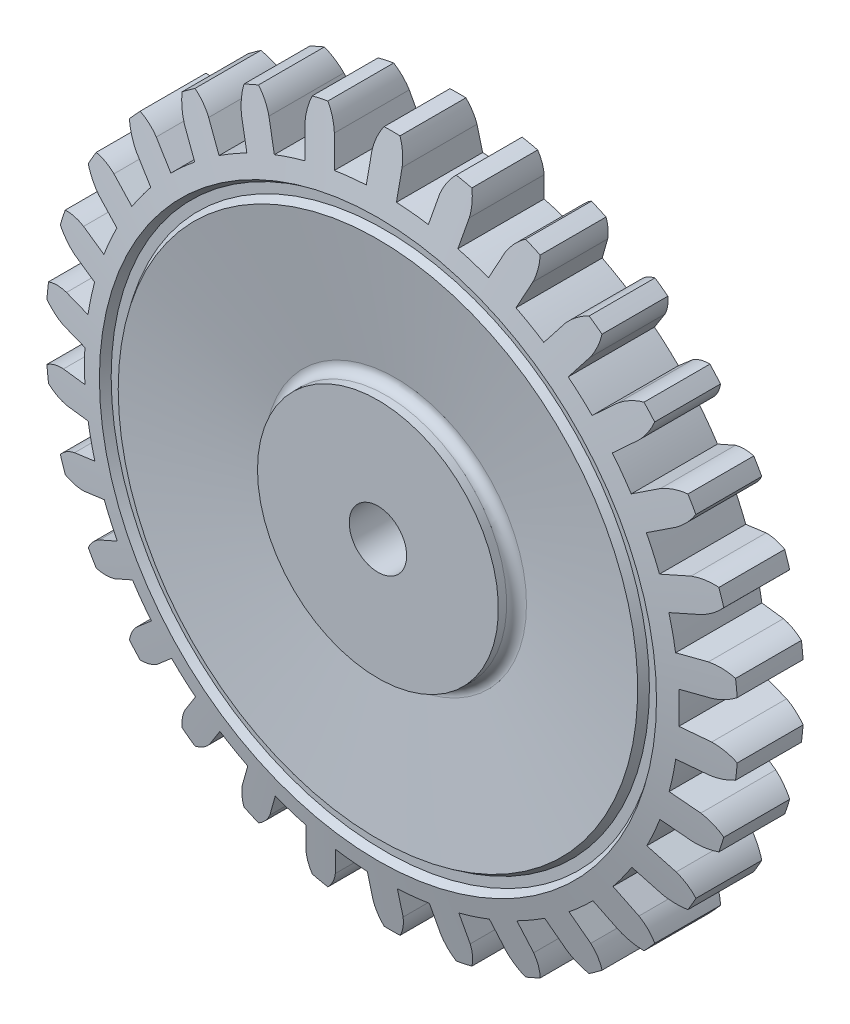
SolidWorks part; units mm, degrees
ref_plane "Front Plane" through (0, 0, 0) normal (0, 0, 1) x (1, 0, 0)
ref_plane "Top Plane" through (0, 0, 0) normal (0, 1, 0) x (1, 0, 0)
ref_plane "Right Plane" through (0, 0, 0) normal (1, 0, 0) x (0, 0, -1)
sketch "Sketch1" plane through (0, 0, 0) normal (1, 0, 0) x (0, 0, -1)
  line L0 (5, 0) -> (-5, 0)
  line L1 (3.5, 36.8) -> (-3.5, 36.8)
  line L2 (-5, 27.6) -> (-3.1331, 13.9182)
  line L3 (-4.25, 29.1) -> (-4.25, 28.1)
  line L4 (-3.5, 36.8) -> (-5, 29.6)
  line L5 (3.5, 36.8) -> (5, 29.6)
  line L6 (5, 12.8) -> (4.1261, 12.8)
  line L7 (-5, 29.6) -> (-4.25, 29.1)
  line L8 (-5, 0) -> (-5, 12.8)
  line L9 (-4.25, 28.1) -> (-5, 27.6)
  line L10 (5, 12.8) -> (5, 0)
  line L11 (5, 0) -> (5.1635, 0.1646)
  line L12 (-4.1261, 12.8) -> (-5, 12.8)
  line L13 (5, 12.8) -> (-5, 12.8) construction
  line L14 (5, 29.6) -> (4.25, 29.1)
  line L15 (4.25, 29.1) -> (4.25, 28.1)
  line L16 (4.25, 28.1) -> (5, 27.6)
  line L17 (-3.1331, 13.9182) -> (-2.9663, 13.8359)
  line L18 (5, 27.6) -> (3.1331, 13.9182)
  arc A0 (3.1331, 13.9182) -> (4.1261, 12.8) centre (4.1261, 13.8) ccw
  arc A1 (-4.1261, 12.8) -> (-3.1331, 13.9182) centre (-4.1261, 13.8) ccw
  point P4 (0, 0)
  point P8 (0, 36.8)
  point P13 (-3, 12.8)
  point P14 (3, 12.8)
  point P17 (3, 12.8)
  point P21 (-3, 12.8)
  dimension "D5" = 1
  dimension "D1" = 10
  dimension "D2" = 7
  dimension "D3" = 0
  dimension "D4" = 36.8
  dimension "D8" = 2
  dimension "D9" = 2
  dimension "D6" = 2
  dimension "D10" = 1
  dimension "D12" = 0.5
  dimension "D7" = 12.8
revolve "Revolve1" add sketch "Sketch1" angle 360 about L0
sketch "Sketch3" plane through (0, 0, 0) normal (0, 0, 1) x (1, 0, 0)
  line L0 (0.84, 36.8) -> (-0.84, 36.8)
  line L1 (5.5464, 34.0512) -> (4.9427, 31.211)
  line L2 (1.5456, 34.4654) -> (1.5456, 31.5622)
  line L3 (-1.6544, 34.4603) -> (-1.6544, 31.5567)
  line L4 (8.4728, 35.8212) -> (6.8295, 36.1705)
  line L5 (8.6775, 33.3909) -> (8.0739, 30.5511)
  line L6 (12.5049, 32.154) -> (11.3238, 29.5014)
  line L7 (15.7353, 33.2768) -> (14.2005, 33.9601)
  line L8 (15.4303, 30.857) -> (14.2494, 28.2049)
  line L9 (18.9168, 28.8514) -> (17.2101, 26.5023)
  line L10 (22.3101, 29.2781) -> (20.9509, 30.2656)
  line L11 (21.5086, 26.9746) -> (19.8022, 24.6259)
  line L12 (24.502, 24.2879) -> (22.3441, 22.345)
  line L13 (27.9098, 23.9998) -> (26.7857, 25.2482)
  line L14 (26.6469, 21.9133) -> (24.4895, 19.9706)
  line L15 (29.0163, 18.6629) -> (26.5016, 17.2111)
  line L16 (32.2897, 17.6725) -> (31.4497, 19.1275)
  line L17 (30.6207, 15.8942) -> (28.1064, 14.4426)
  line L18 (32.2625, 12.2223) -> (29.5009, 11.325)
  line L19 (35.2585, 10.5729) -> (34.7393, 12.1707)
  line L20 (33.2561, 9.1805) -> (30.495, 8.2833)
  line L21 (34.0986, 5.2475) -> (31.2109, 4.9439)
  line L22 (36.6862, 3.0112) -> (36.5106, 4.682)
  line L23 (34.4381, 2.0655) -> (31.5508, 1.7621)
  line L24 (34.4445, -1.9567) -> (31.5567, -1.6532)
  line L25 (36.5106, -4.682) -> (36.6862, -3.0112)
  line L26 (34.115, -5.1397) -> (31.2277, -4.8362)
  line L27 (33.285, -9.0754) -> (30.5234, -8.1781)
  line L28 (34.7393, -12.1707) -> (35.2585, -10.5729)
  line L29 (32.3009, -12.1203) -> (29.5398, -11.2232)
  line L30 (30.6707, -15.7974) -> (28.1561, -14.3455)
  line L31 (31.4497, -19.1275) -> (32.2897, -17.6725)
  line L32 (29.0751, -18.5712) -> (26.5609, -17.1196)
  line L33 (26.716, -21.829) -> (24.5582, -19.886)
  line L34 (26.7857, -25.2482) -> (27.9098, -23.9998)
  line L35 (24.5786, -24.2104) -> (22.4211, -22.2678)
  line L36 (21.5937, -26.9065) -> (19.887, -24.5574)
  line L37 (20.9509, -30.2656) -> (22.3101, -29.2781)
  line L38 (19.0078, -28.7915) -> (17.3014, -26.4428)
  line L39 (15.5277, -30.8081) -> (14.3467, -28.1555)
  line L40 (14.2005, -33.9601) -> (15.7353, -33.2768)
  line L41 (12.6064, -32.1143) -> (11.4256, -29.4621)
  line L42 (8.783, -33.3633) -> (8.1793, -30.5231)
  line L43 (6.8295, -36.1705) -> (8.4728, -35.8212)
  line L44 (5.654, -34.0336) -> (5.0504, -31.1938)
  line L45 (1.6544, -34.4603) -> (1.6544, -31.5567)
  line L46 (-0.84, -36.8) -> (0.84, -36.8)
  line L47 (-1.5456, -34.4654) -> (-1.5456, -31.5622)
  line L48 (-5.5464, -34.0512) -> (-4.9427, -31.211)
  line L49 (-8.4728, -35.8212) -> (-6.8295, -36.1705)
  line L50 (-8.6775, -33.3909) -> (-8.0739, -30.5511)
  line L51 (-12.5049, -32.154) -> (-11.3238, -29.5014)
  line L52 (-15.7353, -33.2768) -> (-14.2005, -33.9601)
  line L53 (-15.4303, -30.857) -> (-14.2494, -28.2049)
  line L54 (-18.9168, -28.8514) -> (-17.2101, -26.5023)
  line L55 (-22.3101, -29.2781) -> (-20.9509, -30.2656)
  line L56 (-21.5086, -26.9746) -> (-19.8022, -24.6259)
  line L57 (-24.502, -24.2879) -> (-22.3441, -22.345)
  line L58 (-27.9098, -23.9998) -> (-26.7857, -25.2482)
  line L59 (-26.6469, -21.9133) -> (-24.4895, -19.9706)
  line L60 (-29.0163, -18.6629) -> (-26.5016, -17.2111)
  line L61 (-32.2897, -17.6725) -> (-31.4497, -19.1275)
  line L62 (-30.6207, -15.8942) -> (-28.1064, -14.4426)
  line L63 (-32.2625, -12.2223) -> (-29.5009, -11.325)
  line L64 (-35.2585, -10.5729) -> (-34.7393, -12.1707)
  line L65 (-33.2561, -9.1805) -> (-30.495, -8.2833)
  line L66 (-34.0986, -5.2475) -> (-31.2109, -4.9439)
  line L67 (-36.6862, -3.0112) -> (-36.5106, -4.682)
  line L68 (-34.4381, -2.0655) -> (-31.5508, -1.7621)
  line L69 (-34.4445, 1.9567) -> (-31.5567, 1.6532)
  line L70 (-36.5106, 4.682) -> (-36.6862, 3.0112)
  line L71 (-34.115, 5.1397) -> (-31.2277, 4.8362)
  line L72 (-33.285, 9.0754) -> (-30.5234, 8.1781)
  line L73 (-34.7393, 12.1707) -> (-35.2585, 10.5729)
  line L74 (-32.3009, 12.1203) -> (-29.5398, 11.2232)
  line L75 (-30.6707, 15.7974) -> (-28.1561, 14.3455)
  line L76 (-31.4497, 19.1275) -> (-32.2897, 17.6725)
  line L77 (-29.0751, 18.5712) -> (-26.5609, 17.1196)
  line L78 (-26.716, 21.829) -> (-24.5582, 19.886)
  line L79 (-26.7857, 25.2482) -> (-27.9098, 23.9998)
  line L80 (-24.5786, 24.2104) -> (-22.4211, 22.2678)
  line L81 (-21.5937, 26.9065) -> (-19.887, 24.5574)
  line L82 (-20.9509, 30.2656) -> (-22.3101, 29.2781)
  line L83 (-19.0078, 28.7915) -> (-17.3014, 26.4428)
  line L84 (-15.5277, 30.8081) -> (-14.3467, 28.1555)
  line L85 (-14.2005, 33.9601) -> (-15.7353, 33.2768)
  line L86 (-12.6064, 32.1143) -> (-11.4256, 29.4621)
  line L87 (-8.783, 33.3633) -> (-8.1793, 30.5231)
  line L88 (-6.8295, 36.1705) -> (-8.4728, 35.8212)
  line L89 (-5.654, 34.0336) -> (-5.0504, 31.1938)
  arc A0 (5.5464, 34.0512) -> (6.8295, 36.1705) centre (10.3318, 32.602) cw
  arc A1 (-1.6544, 31.5567) -> (1.5456, 31.5622) centre (0, 0) ccw
  arc A2 (0.84, 36.8) -> (1.5456, 34.4654) centre (-3.4489, 34.2299) cw
  arc A3 (-1.6544, 34.4603) -> (-0.84, 36.8) centre (3.3277, 34.0376) cw
  arc A4 (8.4728, 35.8212) -> (8.6775, 33.3909) centre (3.7433, 34.199) cw
  arc A5 (12.5049, 32.154) -> (14.2005, 33.9601) centre (16.8843, 29.7415) cw
  arc A6 (15.7353, 33.2768) -> (15.4303, 30.857) centre (10.7718, 32.6734) cw
  arc A7 (18.9168, 28.8514) -> (20.9509, 30.2656) centre (22.699, 25.5811) cw
  arc A8 (22.3101, 29.2781) -> (21.5086, 26.9746) centre (17.3296, 29.7198) cw
  arc A9 (24.502, 24.2879) -> (26.7857, 25.2482) centre (27.5215, 20.3027) cw
  arc A10 (27.9098, 23.9998) -> (26.6469, 21.9133) centre (23.13, 25.4673) cw
  arc A11 (29.0163, 18.6629) -> (31.4497, 19.1275) centre (31.1413, 14.137) cw
  arc A12 (32.2897, 17.6725) -> (30.6207, 15.8942) centre (27.9195, 20.1018) cw
  arc A13 (32.2625, 12.2223) -> (34.7393, 12.1707) centre (33.4, 7.3534) cw
  arc A14 (35.2585, 10.5729) -> (33.2561, 9.1805) centre (31.4888, 13.8577) cw
  arc A15 (34.0986, 5.2475) -> (36.5106, 4.682) centre (34.199, 0.2485) cw
  arc A16 (36.6862, 3.0112) -> (34.4381, 2.0655) centre (33.6819, 7.008) cw
  arc A17 (34.4445, -1.9567) -> (36.6862, -3.0112) centre (33.5034, -6.8673) cw
  arc A18 (36.5106, -4.682) -> (34.115, -5.1397) centre (34.4029, -0.148) cw
  arc A19 (33.285, -9.0754) -> (35.2585, -10.5729) centre (31.3434, -13.683) cw
  arc A20 (34.7393, -12.1707) -> (32.3009, -12.1203) centre (33.6203, -7.2975) cw
  arc A21 (30.6707, -15.7974) -> (32.2897, -17.6725) centre (27.8136, -19.9007) cw
  arc A22 (31.4497, -19.1275) -> (29.0751, -18.5712) centre (31.3684, -14.1281) cw
  arc A23 (26.716, -21.829) -> (27.9098, -23.9998) centre (23.0683, -25.2486) cw
  arc A24 (26.7857, -25.2482) -> (24.5786, -24.2104) centre (27.7455, -20.3412) cw
  arc A25 (21.5937, -26.9065) -> (22.3101, -29.2781) centre (17.3147, -29.493) cw
  arc A26 (20.9509, -30.2656) -> (19.0078, -28.7915) centre (22.91, -25.6654) cw
  arc A27 (15.5277, -30.8081) -> (15.7353, -33.2768) centre (10.8044, -32.4484) cw
  arc A28 (14.2005, -33.9601) -> (12.6064, -32.1143) centre (17.0733, -29.8678) cw
  arc A29 (8.783, -33.3633) -> (8.4728, -35.8212) centre (3.8219, -33.9857) cw
  arc A30 (6.8295, -36.1705) -> (5.654, -34.0336) centre (10.4903, -32.7648) cw
  arc A31 (1.6544, -34.4603) -> (0.84, -36.8) centre (-3.3277, -34.0376) cw
  arc A32 (-0.84, -36.8) -> (-1.5456, -34.4654) centre (3.4489, -34.2299) cw
  arc A33 (-5.5464, -34.0512) -> (-6.8295, -36.1705) centre (-10.3318, -32.602) cw
  arc A34 (-8.4728, -35.8212) -> (-8.6775, -33.3909) centre (-3.7433, -34.199) cw
  arc A35 (-12.5049, -32.154) -> (-14.2005, -33.9601) centre (-16.8843, -29.7415) cw
  arc A36 (-15.7353, -33.2768) -> (-15.4303, -30.857) centre (-10.7718, -32.6734) cw
  arc A37 (-18.9168, -28.8514) -> (-20.9509, -30.2656) centre (-22.699, -25.5811) cw
  arc A38 (-22.3101, -29.2781) -> (-21.5086, -26.9746) centre (-17.3296, -29.7198) cw
  arc A39 (-24.502, -24.2879) -> (-26.7857, -25.2482) centre (-27.5215, -20.3027) cw
  arc A40 (-27.9098, -23.9998) -> (-26.6469, -21.9133) centre (-23.13, -25.4673) cw
  arc A41 (-29.0163, -18.6629) -> (-31.4497, -19.1275) centre (-31.1413, -14.137) cw
  arc A42 (-32.2897, -17.6725) -> (-30.6207, -15.8942) centre (-27.9195, -20.1018) cw
  arc A43 (-32.2625, -12.2223) -> (-34.7393, -12.1707) centre (-33.4, -7.3534) cw
  arc A44 (-35.2585, -10.5729) -> (-33.2561, -9.1805) centre (-31.4888, -13.8577) cw
  arc A45 (-34.0986, -5.2475) -> (-36.5106, -4.682) centre (-34.199, -0.2485) cw
  arc A46 (-36.6862, -3.0112) -> (-34.4381, -2.0655) centre (-33.6819, -7.008) cw
  arc A47 (-34.4445, 1.9567) -> (-36.6862, 3.0112) centre (-33.5034, 6.8673) cw
  arc A48 (-36.5106, 4.682) -> (-34.115, 5.1397) centre (-34.4029, 0.148) cw
  arc A49 (-33.285, 9.0754) -> (-35.2585, 10.5729) centre (-31.3434, 13.683) cw
  arc A50 (-34.7393, 12.1707) -> (-32.3009, 12.1203) centre (-33.6203, 7.2975) cw
  arc A51 (-30.6707, 15.7974) -> (-32.2897, 17.6725) centre (-27.8136, 19.9007) cw
  arc A52 (-31.4497, 19.1275) -> (-29.0751, 18.5712) centre (-31.3684, 14.1281) cw
  arc A53 (-26.716, 21.829) -> (-27.9098, 23.9998) centre (-23.0683, 25.2486) cw
  arc A54 (-26.7857, 25.2482) -> (-24.5786, 24.2104) centre (-27.7455, 20.3412) cw
  arc A55 (-21.5937, 26.9065) -> (-22.3101, 29.2781) centre (-17.3147, 29.493) cw
  arc A56 (-20.9509, 30.2656) -> (-19.0078, 28.7915) centre (-22.91, 25.6654) cw
  arc A57 (-15.5277, 30.8081) -> (-15.7353, 33.2768) centre (-10.8044, 32.4484) cw
  arc A58 (-14.2005, 33.9601) -> (-12.6064, 32.1143) centre (-17.0733, 29.8678) cw
  arc A59 (-8.783, 33.3633) -> (-8.4728, 35.8212) centre (-3.8219, 33.9857) cw
  arc A60 (-6.8295, 36.1705) -> (-5.654, 34.0336) centre (-10.4903, 32.7648) cw
  circle A61 centre (0, 0) radius 36.8 construction
  circle A62 centre (0, 0) radius 36.8
  point P7 (0, 36.8)
  point P245 (0, 0)
  dimension "D1" = 30
  dimension "D2" = 63.2
  dimension "D7" = 5
  dimension "D8" = 5
  dimension "D3" = 1.68
  dimension "D4" = 0
extrude "Cut-Extrude1" cut sketch "Sketch3" against normal through all both and the other way through all contours A57 A62 A56 L83 A1 L84 | A59 A62 A58 L86 A1 L87 | A3 A62 A60 L89 A1 L3 | A0 A62 A2 L2 A1 L1 | A5 A62 A4 L5 A1 L6 | A7 A62 A6 L8 A1 L9 | A9 A62 A8 L11 A1 L12 | A11 A62 A10 L14 A1 L15 | A13 A62 A12 L17 A1 L18 | A15 A62 A14 L20 A1 L21 | A17 A62 A16 L23 A1 L24 | A19 A62 A18 L26 A1 L27 | A21 A62 A20 L29 A1 L30 | A23 A62 A22 L32 A1 L33 | A25 A62 A24 L35 A1 L36 | A27 A62 A26 L38 A1 L39 | A29 A62 A28 L41 A1 L42 | A31 A62 A30 L44 A1 L45 | A33 A62 A32 L47 A1 L48 | A35 A62 A34 L50 A1 L51 | A37 A62 A36 L53 A1 L54 | A39 A62 A38 L56 A1 L57 | A41 A62 A40 L59 A1 L60 | A43 A62 A42 L62 A1 L63 | A45 A62 A44 L65 A1 L66 | A47 A62 A46 L68 A1 L69 | A49 A62 A48 L71 A1 L72 | A51 A62 A50 L74 A1 L75 | A53 A62 A52 L77 A1 L78 | A55 A62 A54 L80 A1 L81
sketch "Sketch4" plane through (0, 0, -5) normal (0, 0, -1) x (-1, 0, 0)
  circle A0 centre (0, 0) radius 3.05
  dimension "D1" = 6.1
extrude "Cut-Extrude2" cut sketch "Sketch4" against normal through all
